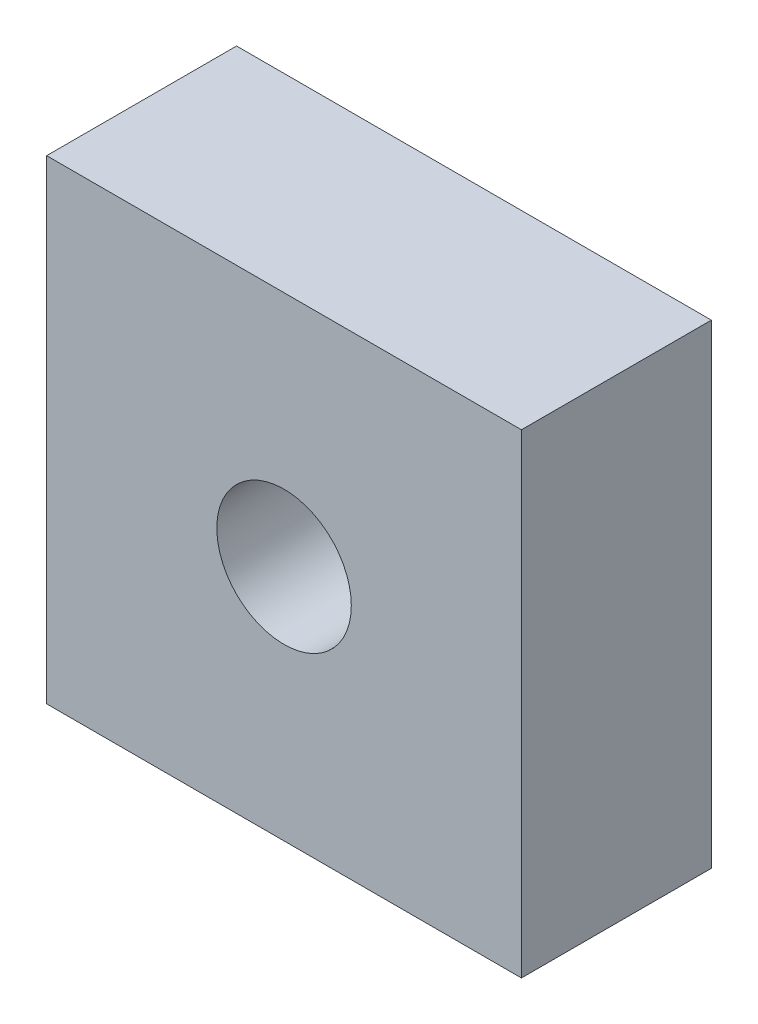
SolidWorks part; units mm, degrees
ref_plane "Face" through (0, 0, 0) normal (0, 0, 1) x (1, 0, 0)
ref_plane "Dessus" through (0, 0, 0) normal (0, 1, 0) x (1, 0, 0)
ref_plane "Droite" through (0, 0, 0) normal (1, 0, 0) x (0, 0, -1)
sketch "Esquisse1" plane through (0, 0, 0) normal (0, 0, 1) x (1, 0, 0)
  line L1 (0, 0) -> (30, 0)
  line L2 (0, 0) -> (0, -30)
  line L3 (0, -30) -> (30, -30)
  line L4 (30, 0) -> (30, -30)
  circle A0 centre (15, -15) radius 4.25
  dimension "D3" = 8.5
  dimension "D1" = 30
  dimension "D2" = 30
  dimension "D4" = 15
  dimension "D5" = 15
extrude "Base-Extrusion" add sketch "Esquisse1" along normal blind 12
